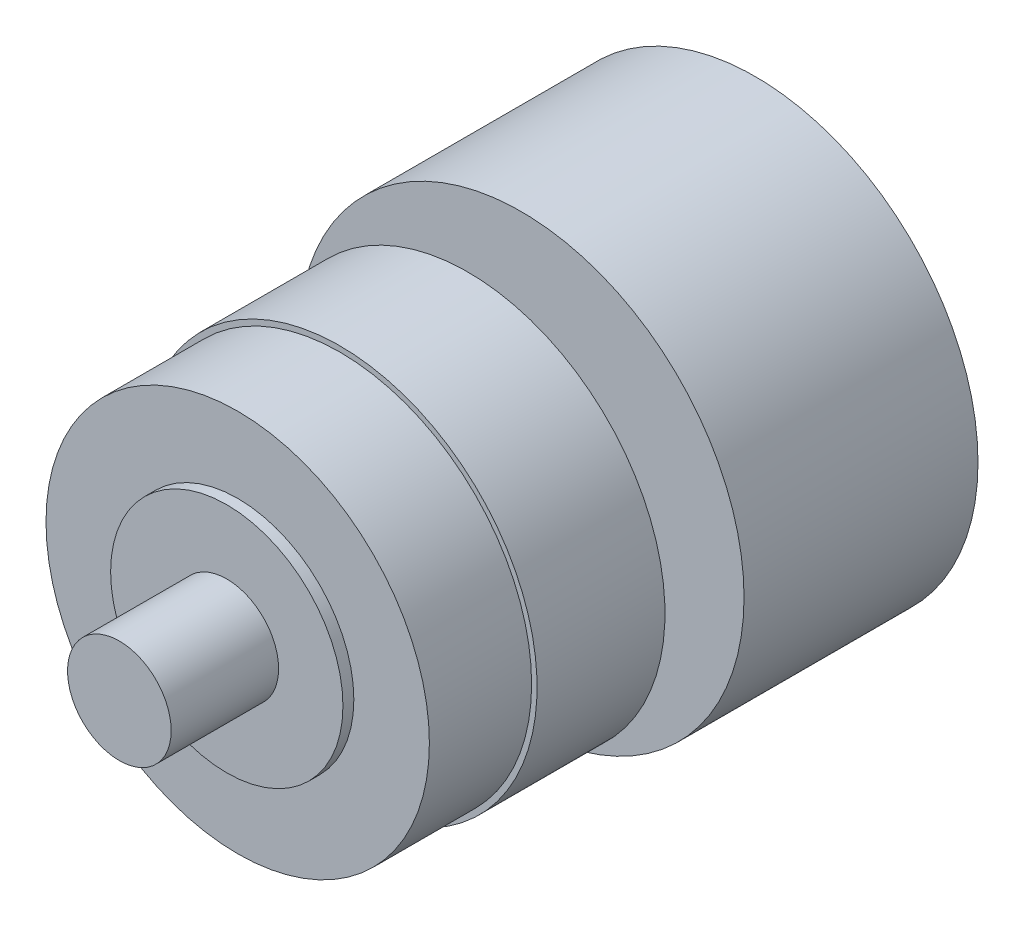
SolidWorks part; units mm, degrees
ref_plane "Front" through (0, 0, 0) normal (0, 0, 1) x (1, 0, 0)
ref_plane "Top" through (0, 0, 0) normal (0, 1, 0) x (1, 0, 0)
ref_plane "Right" through (0, 0, 0) normal (1, 0, 0) x (0, 0, -1)
sketch "Sketch1" plane through (0, 0, 0) normal (0, 0, 1) x (1, 0, 0)
  circle A0 centre (0, 0) radius 2.413
  dimension "D1" = 4.826
extrude "Extrude1" add sketch "Sketch1" against normal blind 5.0038
sketch "Sketch2" plane through (0, 0, -5.0038) normal (0, 0, -1) x (-1, 0, 0)
  circle A0 centre (0, 0) radius 5.4102
  dimension "D1" = 10.8204
extrude "Extrude2" add sketch "Sketch2" along normal blind 0.508
sketch "Sketch3" plane through (0, 0, -5.5118) normal (0, 0, -1) x (-1, 0, 0)
  circle A0 centre (0, 0) radius 8.9281
extrude "Extrude3" add sketch "Sketch3" along normal blind 4.7625
sketch "Sketch4" plane through (0, 0, -10.2743) normal (0, 0, -1) x (-1, 0, 0)
  circle A0 centre (0, 0) radius 9.1821
extrude "Extrude4" add sketch "Sketch4" along normal blind 5.9563
sketch "Sketch6" plane through (0, 0, -16.2306) normal (0, 0, -1) x (-1, 0, 0)
  circle A0 centre (0, 0) radius 6.35
  dimension "D1" = 12.7
extrude "Extrude5" add sketch "Sketch6" along normal blind 2.2352 draft 45
sketch "Sketch7" plane through (0, 0, -18.4658) normal (0, 0, -1) x (-1, 0, 0)
  circle A0 centre (0, 0) radius 4.1148
  circle A2 centre (0, 0) radius 4.1148 construction
extrude "Extrude6" add sketch "Sketch7" along normal blind 0.254
sketch "Sketch8" plane through (0, 0, -18.7198) normal (0, 0, -1) x (-1, 0, 0)
  circle A0 centre (0, 0) radius 10.3759
  dimension "D1" = 20.7518
extrude "Extrude7" add sketch "Sketch8" along normal blind 10.8966
sketch "Sketch9" plane through (0, 0, -29.6164) normal (0, 0, -1) x (-1, 0, 0)
  circle A0 centre (0, 0) radius 5.08
  dimension "D1" = 10.16
extrude "Extrude8" add sketch "Sketch9" along normal blind 0.127
sketch "Sketch10" plane through (0, 0, -29.7434) normal (0, 0, -1) x (-1, 0, 0)
  line L1 (7.3323, 0) -> (3.6662, 6.35)
  line L2 (3.6662, 6.35) -> (-3.6662, 6.35)
  line L3 (-3.6662, 6.35) -> (-7.3323, 0)
  line L4 (-7.3323, 0) -> (-3.6662, -6.35)
  line L5 (-3.6662, -6.35) -> (3.6662, -6.35)
  line L6 (3.6662, -6.35) -> (7.3323, 0)
  circle A0 centre (0, 0) radius 6.35 construction
  dimension "D1" = 12.7
extrude "Extrude9" add sketch "Sketch10" along normal blind 1.524
sketch "Sketch11" plane through (0, 0, -31.2674) normal (0, 0, -1) x (-1, 0, 0)
  circle A0 centre (0, 0) radius 6.3373
  dimension "D1" = 12.6746
extrude "Cut-Extrude1" cut sketch "Sketch11" against normal blind 1.524 draft 45 flip side to cut
ref_plane "giude face" through (0, 0, -17.7292) normal (0, 0, -1) x (-1, 0, 0)
